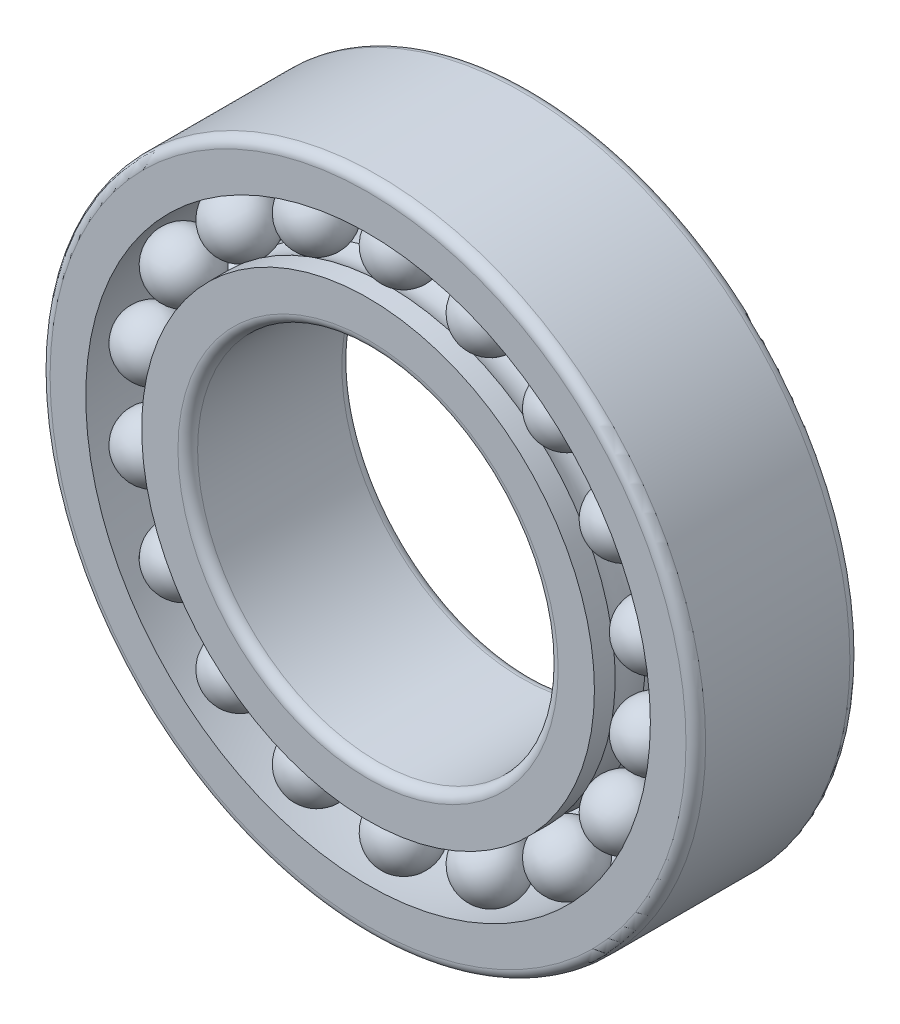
SolidWorks part; units mm, degrees
ref_plane "Front Plane" through (0, 0, 0) normal (0, 0, 1) x (1, 0, 0)
ref_plane "Top Plane" through (0, 0, 0) normal (0, 1, 0) x (1, 0, 0)
ref_plane "Right Plane" through (0, 0, 0) normal (1, 0, 0) x (0, 0, -1)
other "Configuration Table"
sketch "BaseSke" plane through (0, 0, 0) normal (1, 0, 0) x (0, 0, -1)
  line L0 (-47.2296, 0) -> (24.6132, 0) construction
  line L1 (-47.2296, 38.75) -> (24.6132, 38.75) construction
  line L2 (0, 129.5214) -> (0, -86.3012) construction
  line L3 (-7.0673, 43.5577) -> (-7.0673, 33.9423)
  line L4 (-12.5, 50) -> (12.5, 50) construction
  line L5 (-12.5, 27.5) -> (12.5, 27.5) construction
  line L6 (-12.5, 50) -> (-12.5, 27.5) construction
  line L7 (12.5, 50) -> (12.5, 27.5) construction
  line L8 (-11.875, 50) -> (-11.875, 27.5) construction
  arc A0 (-7.0673, 43.5577) -> (-7.0673, 33.9423) centre (-7.0673, 38.75) ccw
revolve "Ball" add sketch "BaseSke" angle 360 about L3
sketch "OuterRaceSke" plane through (0, 0, 0) normal (1, 0, 0) x (0, 0, -1)
  line L0 (0, 0) -> (0, 87.5396) construction
  line L1 (-12.5, 50) -> (12.5, 50)
  line L2 (-12.5, 50) -> (-12.5, 43.0628)
  line L4 (12.5, 50) -> (12.5, 43.0628)
  line L5 (-50.3916, 0) -> (55.2197, 0) construction
  arc A0 (-12.5, 43.0628) -> (12.5, 43.0628) centre (0, -66.2247) cw
  arc A1 (-12.5, 43.0829) -> (12.5, 43.0829) centre (0, -66.2247) cw construction
  arc A2 (-7.0673, 43.5577) -> (-7.0673, 33.9423) centre (-7.0673, 38.75) ccw construction
revolve "OuterRace" add sketch "OuterRaceSke" angle 360 about L5
mirror "MirrorBall" about plane through (0, 0, 0) normal (0, 0, 1) of "Ball"
sketch "InnerRaceSke" plane through (0, 0, 0) normal (1, 0, 0) x (0, 0, -1)
  line L0 (-70.8626, 0) -> (113.5527, 0) construction
  line L1 (0, 58.441) -> (0, -70.8113) construction
  line L2 (-12.5, 27.5) -> (12.5, 27.5)
  line L3 (-12.5, 27.5) -> (-12.5, 34.5312)
  line L4 (-12.5, 34.5312) -> (-9.352, 34.5313)
  line L5 (12.5, 27.5) -> (12.5, 34.5312)
  line L6 (0, 129.5214) -> (0, -86.3012) construction
  line L7 (-4.7826, 34.5313) -> (4.7826, 34.5313)
  line L8 (12.5, 34.5312) -> (9.352, 34.5313)
  arc A0 (-9.352, 34.5313) -> (-4.7826, 34.5313) centre (-7.0673, 38.75) ccw
  circle A1 centre (-7.0673, 38.75) radius 4.8077 construction
  arc A2 (9.352, 34.5313) -> (4.7826, 34.5313) centre (7.0673, 38.75) cw
  point P17 (0, 27.5)
  point P23 (0, 34.5312)
revolve "InnerRace" add sketch "InnerRaceSke" angle 360 about L0
fillet "Fillet1" radius 1.5 4 edges at (27.5, 0, -12.5) (27.5, 0, 12.5) (50, 0, -12.5) (50, 0, 12.5)
pattern_circular "CirPatternBall" count 18 over 360 about axis through (0, 0, 0) along (0, 0, 1) of "Ball", "MirrorBall"
sketch "TaperSke" plane through (0, 0, 0) normal (1, 0, 0) x (0, 0, -1)
  line L0 (-12.5, 27.5) -> (12.5, 27.5)
  line L1 (12.5, 27.5) -> (12.5, 29.5833)
  line L2 (12.5, 29.5833) -> (-12.5, 27.5)
  line L7 (-41.2502, 0) -> (40.8606, 0) construction
revolve "Taper" [suppressed] cut sketch "TaperSke" angle 360 about L7
fillet "Fillet2" [suppressed] radius 1.5
sketch "SimplifiedSke" plane through (0, 0, 0) normal (1, 0, 0) x (0, 0, -1)
  line L0 (37.5911, 0) -> (-37.5911, 0) construction
  line L1 (0, 0) -> (0, 72.9012) construction
  circle A0 centre (-7.0673, 38.75) radius 4.8077
  circle A1 centre (-7.0673, 38.75) radius 4.8077 construction
  circle A2 centre (7.0673, 38.75) radius 4.8077
revolve "Simplified" [suppressed] add sketch "SimplifiedSke" angle 360 about L0
equation "\"D1@BaseSke\" =  (\"Bearing_Outside_Diameter@BaseSke\"  +  \"Bearing_Inside_Diameter@BaseSke\"  )  / 4"
equation "\"Ball_diameter@BaseSke\" = \"Bearing_Thickness@BaseSke\" / 2.6"
equation "\"D2@BaseSke\" = \"Bearing_Thickness@BaseSke\"/40"
equation "\"D1@OuterRaceSke\" = \"Bearing_Inside_Diameter@BaseSke\"*2"
equation "\"D1@InnerRaceSke\" = \"Bearing_Inside_Diameter@BaseSke\" +  ( \"Bearing_Outside_Diameter@BaseSke\" - \"Bearing_Inside_Diameter@BaseSke\" )  / 3.2"
equation "\"D2@InnerRaceSke\" = \"Ball_diameter@BaseSke\"-0.02"
equation "\"D1@CirPatternBall\" = int( \"D1@BaseSke\"* pi  * 2 / \"Ball_diameter@BaseSke\" /1.4)"
equation "\"Taper@TaperSke\" = \"Bearing_Thickness@BaseSke\"/12"
equation "\"D1@Fillet2\" = \"Fillet_radius@Fillet1\""
